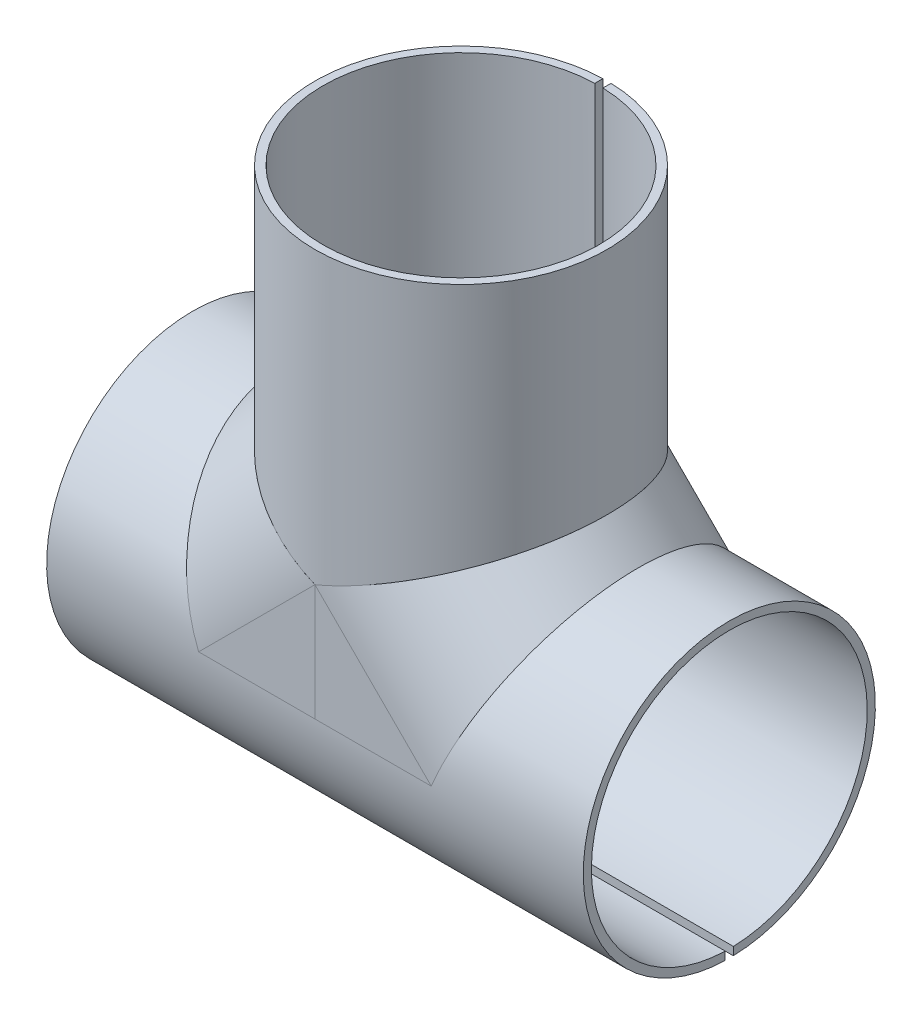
SolidWorks part; units mm, degrees
ref_plane "前视基准面" through (0, 0, 0) normal (0, 0, 1) x (1, 0, 0)
ref_plane "上视基准面" through (0, 0, 0) normal (0, 1, 0) x (1, 0, 0)
ref_plane "右视基准面" through (0, 0, 0) normal (1, 0, 0) x (0, 0, -1)
sketch "草图1" plane through (0, 0, 0) normal (0, 0, 1) x (1, 0, 0)
  line L0 (0, 50) -> (0, 0) construction
  line L1 (-33, 0) -> (33, 0) construction
  line L2 (-17.963, 50) -> (17.963, 50) construction
  line L3 (33, 17.963) -> (33, -17.963) construction
  line L4 (17.963, 50) -> (17.963, 21.7467) construction
  line L5 (17.963, 21.7467) -> (21.7467, 17.963) construction
  line L6 (21.7467, 17.963) -> (33, 17.963) construction
  line L7 (21.7467, 17.963) -> (14.3062, 0) construction
  line L8 (0, 14.3062) -> (-14.3062, 0) construction
  line L9 (17.963, 21.7467) -> (0, 14.3062) construction
  line L10 (7.1531, 7.1531) -> (19.8549, 19.8549) construction
  line L11 (-17.963, 50) -> (-17.963, 21.7467) construction
  line L12 (-17.963, 21.7467) -> (-21.7467, 17.963) construction
  line L13 (-21.7467, 17.963) -> (-33, 17.963) construction
  line L14 (-33, 17.963) -> (-33, -17.963) construction
  line L15 (0, 14.3062) -> (-17.963, 21.7467) construction
  line L16 (14.3062, 0) -> (0, 14.3062) construction
  line L17 (-14.3062, 0) -> (-21.7467, 17.963) construction
  line L18 (17.963, 21.7467) -> (-17.963, 21.7467) construction
  line L19 (0, 50) -> (17.963, 50) construction
  line L20 (0, 14.3062) -> (0, 21.7467) construction
  line L21 (0, 0) -> (0, -1) construction
  line L22 (0, 0) -> (0, 50)
  dimension "D1" = 45
  dimension "L3" = 66
  dimension "L1" = 50
  dimension "R" = 17.963
  dimension "L2" = 14.3062
  dimension "t" = 1
sketch "草图2" plane through (0, 0, 0) normal (0, 1, 0) x (1, 0, 0)
  line L0 (0, 17.963) -> (0, -17.963) construction
  circle A0 centre (0, 0) radius 17.963
extrude "拉伸-薄壁1" add sketch "草图2" along normal up to vertex thin
sketch "草图3" plane through (0, 0, 0) normal (1, 0, 0) x (0, 0, -1)
  circle A0 centre (0, 0) radius 17.963
extrude "拉伸-薄壁2" add sketch "草图3" along normal up to vertex and the other way up to vertex separate body thin
ref_plane "基准面1" through (0, 14.3062, 0) normal (-0.7071, 0.7071, 0) x (0, 0, 1)
ref_plane "基准面2" through (0, 14.3062, 0) normal (-0.7071, -0.7071, 0) x (0, 0, 1)
sketch "草图4" plane through (0, 14.3062, 0) normal (-0.7071, 0.7071, 0) x (0, 0, 1)
  circle A0 centre (0, 0) radius 17.963
extrude "拉伸-薄壁3" add sketch "草图4" against normal up to vertex separate body thin
sketch "草图8" plane through (0, 0, 0) normal (0, 0, 1) x (1, 0, 0)
  line L0 (17.963, 21.7467) -> (0, 14.3062) construction
  line L1 (14.3062, 0) -> (0, 14.3062) construction
  line L2 (21.7467, 17.963) -> (14.3062, 0) construction
  line L3 (17.963, 21.7467) -> (21.7467, 17.963) construction
  line L4 (17.963, 21.7467) -> (0, 14.3062)
  line L5 (14.3062, 0) -> (0, 14.3062)
  line L6 (21.7467, 17.963) -> (14.3062, 0)
  line L7 (17.963, 21.7467) -> (21.7467, 17.963)
extrude "切除-拉伸2" cut sketch "草图8" against normal through all and the other way through all flip side to cut
sketch "草图5" plane through (0, 14.3062, 0) normal (-0.7071, -0.7071, 0) x (0, 0, 1)
  circle A0 centre (0, 0) radius 17.963
extrude "拉伸-薄壁4" add sketch "草图5" along normal up to vertex separate body thin
sketch "草图9" plane through (0, 0, 0) normal (0, 0, 1) x (1, 0, 0)
  line L0 (0, 14.3062) -> (-17.963, 21.7467) construction
  line L1 (-14.3062, 0) -> (-21.7467, 17.963) construction
  line L2 (0, 14.3062) -> (-14.3062, 0) construction
  line L3 (-17.963, 21.7467) -> (-21.7467, 17.963) construction
  line L4 (0, 14.3062) -> (-17.963, 21.7467)
  line L5 (-14.3062, 0) -> (-21.7467, 17.963)
  line L6 (0, 14.3062) -> (-14.3062, 0)
  line L7 (-17.963, 21.7467) -> (-21.7467, 17.963)
extrude "切除-拉伸3" cut sketch "草图9" against normal through all and the other way through all flip side to cut
ref_plane "基准面3" through (0, 0, 17.963) normal (0, 0, 1) x (1, 0, 0)
sketch "草图7" plane through (0, 0, 17.963) normal (0, 0, 1) x (1, 0, 0)
  line L1 (0, 14.3062) -> (-14.3062, 0)
  line L2 (-14.3062, 0) -> (0, 0)
  line L3 (0, 0) -> (0, 14.3062)
extrude "凸台-拉伸1" add sketch "草图7" against normal blind 1
sketch "草图10" plane through (0, 0, 17.963) normal (0, 0, 1) x (1, 0, 0)
  line L0 (0, 14.3062) -> (0, 0)
  line L1 (0, 0) -> (14.3062, 0)
  line L2 (14.3062, 0) -> (0, 14.3062)
extrude "凸台-拉伸2" add sketch "草图10" against normal blind 1
mirror "镜向1" about plane through (0, 0, 0) normal (0, 0, 1) of "凸台-拉伸1"
mirror "镜向2" about plane through (0, 0, 0) normal (0, 0, 1) of "凸台-拉伸2"
sketch "草图6" plane through (0, 0, 0) normal (0, 0, 1) x (1, 0, 0)
  line L0 (-17.963, 21.7467) -> (0, 14.3062)
  line L1 (0, 14.3062) -> (17.963, 21.7467)
  line L3 (17.963, 21.7467) -> (17.963, 50)
  line L4 (17.963, 50) -> (-17.963, 50)
  line L5 (-17.963, 50) -> (-17.963, 21.7467)
extrude "切除-拉伸1" cut sketch "草图6" against normal through all and the other way through all flip side to cut
sketch "草图11" plane through (0, 0, 0) normal (0, 0, 1) x (1, 0, 0)
  line L0 (-14.3062, 0) -> (-21.7467, 17.963) construction
  line L1 (21.7467, 17.963) -> (14.3062, 0) construction
  line L2 (-14.3062, 0) -> (-21.7467, 17.963)
  line L3 (21.7467, 17.963) -> (14.3062, 0)
  line L4 (-14.3062, 0) -> (14.3062, 0)
  line L5 (-21.7467, 17.963) -> (21.7467, 17.963)
extrude "切除-拉伸4" cut sketch "草图11" against normal through all and the other way through all
sketch "草图12" plane through (0, 0, 0) normal (0, 1, 0) x (1, 0, 0)
  line L0 (-33, 0) -> (33, 0)
extrude "切除-拉伸-薄壁1" cut sketch "草图12" against normal through all thin
extrude "切除-拉伸-薄壁2" cut sketch "草图1" against normal through all thin
equation "\"D5@拉伸-薄壁1\" = \"t@草图1\""
equation "\"D5@拉伸-薄壁2\" = \"t@草图1\""
equation "\"D5@拉伸-薄壁3\" = \"t@草图1\""
equation "\"D5@拉伸-薄壁4\" = \"t@草图1\""
equation "\"D1@凸台-拉伸1\" = \"t@草图1\""
equation "\"D1@凸台-拉伸2\" = \"t@草图1\""
